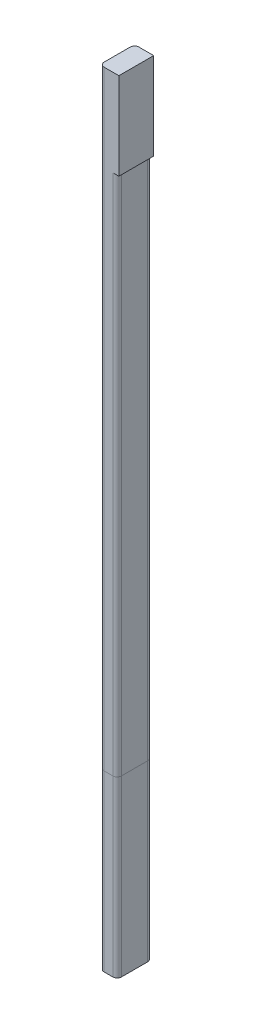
SolidWorks part; units mm, degrees
ref_plane "Спереди" through (0, 0, 0) normal (0, 0, 1) x (1, 0, 0)
ref_plane "Сверху" through (0, 0, 0) normal (0, 1, 0) x (1, 0, 0)
ref_plane "Справа" through (0, 0, 0) normal (1, 0, 0) x (0, 0, -1)
sketch "Эскиз10" plane through (0, 0, 0) normal (0, 1, 0) x (1, 0, 0)
  line L1 (0.5, -1.5) -> (-0.5, -1.5)
  line L2 (0.5, -1.5) -> (0.5, 1.5)
  line L3 (0.5, 1.5) -> (-0.5, 1.5)
  line L4 (-0.5, -1.5) -> (-0.5, 1.5)
  line L5 (0.5, -1.5) -> (-0.5, 1.5) construction
  line L6 (0.5, 1.5) -> (-0.5, -1.5) construction
  point P0 (0, 0)
  dimension "D1" = 1
  dimension "D2" = 3
extrude "Вытянуть-Тонкостенный2" add sketch "Эскиз10" along normal blind 90 thin
sketch "Эскиз11" plane through (1, 0, 0) normal (1, 0, 0) x (0, 0, -1)
  line L0 (-2, 90) -> (-2, 0) construction
  line L1 (2, 90) -> (-2, 90)
  line L2 (2, 90) -> (2, 80)
  line L3 (2, 80) -> (-2, 80)
  line L4 (-2, 90) -> (-2, 80)
  point P7 (0, 90)
  dimension "D1" = 10
extrude "Бобышка-Вытянуть2" add sketch "Эскиз11" along normal blind 0.2
sketch "Эскиз12" plane through (0, 0, 0) normal (0, -1, 0) x (1, 0, 0)
  line L1 (1, -2) -> (-2.0346, -2)
  line L2 (1, -2) -> (1, 2)
  line L3 (1, 2) -> (-2.0346, 2)
  line L4 (-2.0346, -2) -> (-2.0346, 2)
extrude "Вырез-Вытянуть1" cut sketch "Эскиз12" against normal blind 20
sketch "Эскиз16" plane through (0, 20, 0) normal (0, -1, 0) x (1, 0, 0)
  line L1 (0.5, -1.5) -> (-0.5, -1.5)
  line L2 (0.5, -1.5) -> (0.5, 1.5)
  line L3 (0.5, 1.5) -> (-0.5, 1.5)
  line L4 (-0.5, -1.5) -> (-0.5, 1.5)
extrude "Вытянуть-Тонкостенный3" add sketch "Эскиз16" along normal blind 20 separate body thin
sketch "Эскиз17" plane through (0, 0, 0) normal (0, -1, 0) x (1, 0, 0)
  line L1 (-0.5, -1.5) -> (0.5, -1.5)
  line L2 (-0.5, -1.5) -> (-0.5, 1.5)
  line L3 (-0.5, 1.5) -> (0.5, 1.5)
  line L4 (0.5, -1.5) -> (0.5, 1.5)
extrude "Бобышка-Вытянуть4" add sketch "Эскиз17" against normal blind 0.5
fillet "Скругление3" radius 0.5 8 edges at (1, 10, 2) (-1, 10, 2) (1, 10, -2) (-1, 10, -2) (0.5, 10.25, 1.5) (0.5, 10.25, -1.5) (-0.5, 10.25, 1.5) (-0.5, 10.25, -1.5)
fillet "Скругление4" radius 0.5 8 edges at (-0.5, 54.5, 1.5) (0.5, 54.5, 1.5) (-0.5, 54.5, -1.5) (0.5, 54.5, -1.5) (1, 50, -2) (1, 50, 2) (-1, 55, 2) (-1, 55, -2)
